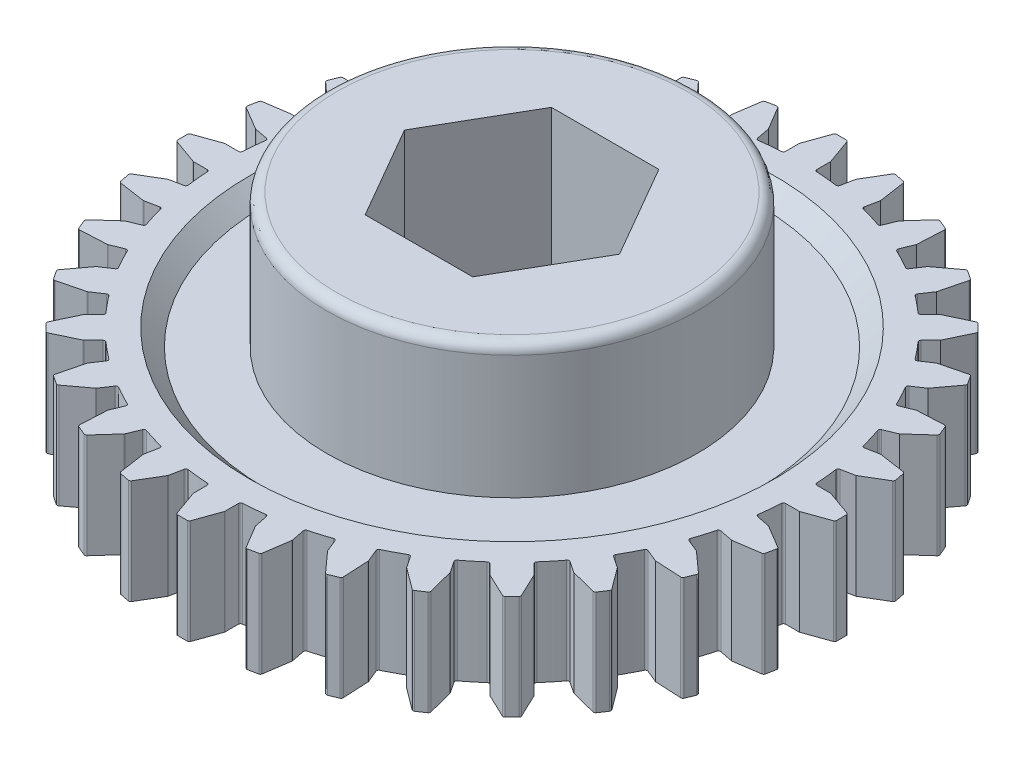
SolidWorks part; units mm, degrees
ref_plane "Front" through (0, 0, 0) normal (0, 0, 1) x (1, 0, 0)
ref_plane "Top" through (0, 0, 0) normal (0, 1, 0) x (1, 0, 0)
ref_plane "Right" through (0, 0, 0) normal (1, 0, 0) x (0, 0, -1)
sketch "Sketch1" plane through (0, 0, 0) normal (0, 1, 0) x (1, 0, 0)
  circle A0 centre (0, 0) radius 17.4625
  dimension "D1" = 34.925
extrude "Extrude1" add sketch "Sketch1" along normal blind 6.35
sketch "Sketch2" plane through (0, 6.35, 0) normal (0, 1, 0) x (-1, 0, 0)
  circle A0 centre (0, 0) radius 11.2395
  dimension "D1" = 22.479
extrude "Extrude2" add sketch "Sketch2" along normal blind 7.112
sketch "Sketch3" plane through (0, 0, 0) normal (0, -1, 0) x (1, 0, 0)
  circle A0 centre (0, 0) radius 15.113
  circle A1 centre (0, 0) radius 6.985
  dimension "D1" = 13.97
  dimension "D2" = 30.226
extrude "Cut-Extrude1" cut sketch "Sketch3" against normal blind 1.651
sketch "Sketch4" plane through (0, 6.35, 0) normal (0, 1, 0) x (-1, 0, 0)
  circle A0 centre (0, 0) radius 11.2395
  circle A1 centre (0, 0) radius 14.9225
  circle A2 centre (0, 0) radius 11.2395 construction
  dimension "D1" = 29.845
extrude "Cut-Extrude2" cut sketch "Sketch4" against normal blind 1.016
chamfer "Chamfer1" distance 1.016 angle 45 1 edges at (0, 6.35, 14.9225)
sketch "Sketch5" plane through (0, 13.462, 0) normal (0, 1, 0) x (-1, 0, 0)
  line L1 (6.5258, 0) -> (3.2629, 5.6515)
  line L2 (3.2629, 5.6515) -> (-3.2629, 5.6515)
  line L3 (-3.2629, 5.6515) -> (-6.5258, 0)
  line L4 (-6.5258, 0) -> (-3.2629, -5.6515)
  line L5 (-3.2629, -5.6515) -> (3.2629, -5.6515)
  line L6 (3.2629, -5.6515) -> (6.5258, 0)
  circle A0 centre (0, 0) radius 5.6515 construction
  dimension "D1" = 11.303
extrude "Cut-Extrude3" cut sketch "Sketch5" against normal through all
fillet "Fillet1" radius 0.635 1 edges at (0, 13.462, 11.2395)
sketch "Sketch6" plane through (0, 6.35, 0) normal (0, 1, 0) x (-1, 0, 0)
  line L0 (0.9525, -18.3903) -> (0.381, -19.9989)
  line L1 (0.9525, -16.4478) -> (0, -16.4478)
  line L2 (0.9525, -18.3903) -> (0.9525, -16.4478)
  line L3 (0, -16.4478) -> (-0.9525, -16.4478)
  line L4 (-0.9525, -18.3903) -> (-0.9525, -16.4478)
  line L5 (-0.9525, -18.3903) -> (-0.381, -19.9989)
  arc A0 (-0.381, -19.9989) -> (0.381, -19.9989) centre (0, 0) ccw
  dimension "D1" = 20.0025
  dimension "D4" = 0.762
  dimension "D2" = 18.415
  dimension "D3" = 1.905
extrude "Extrude3" add sketch "Sketch6" against normal up to surface
fillet "Fillet3" radius 0.127 5 edges at (-0.9525, 3.175, -17.4365) (-0.9525, 3.175, -18.3903) (-0.381, 3.175, -19.9989) (0.381, 3.175, -19.9989) (0.9525, 3.175, -17.4365)
pattern_circular "CirPattern1" count 32 over 360 about axis through (0, 0, 0) along (0, 1, 0) of "Extrude3", "Fillet3"
